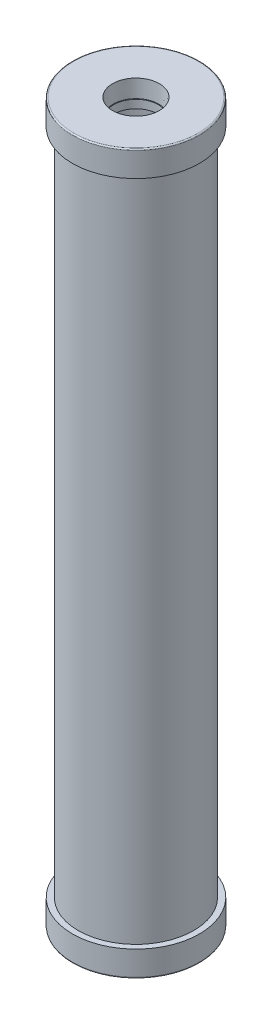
SolidWorks part; units mm, degrees
ref_plane "Front Plane" through (0, 0, 0) normal (0, 0, 1) x (1, 0, 0)
ref_plane "Top Plane" through (0, 0, 0) normal (0, 1, 0) x (1, 0, 0)
ref_plane "Right Plane" through (0, 0, 0) normal (1, 0, 0) x (0, 0, -1)
sketch "Sketch1" plane through (0, 0, 0) normal (0, 1, 0) x (1, 0, 0)
  circle A0 centre (0, 0) radius 57.15
  circle A1 centre (0, 0) radius 50.546
  dimension "D1" = 114.3
  dimension "D2" = 6.604
extrude "Boss-Extrude1" add sketch "Sketch1" along normal blind 711.2
sketch "Sketch2" plane through (0, 0, 0) normal (0, 1, 0) x (1, 0, 0)
  circle A0 centre (0, 0) radius 62.865
  dimension "D1" = 125.73
extrude "Boss-Extrude2" add sketch "Sketch2" along normal blind 25.4
hole_wizard "1-1/2 NPT Tapped Hole1" positions "Sketch4" profile "Sketch3" size "1-1/2" standard "ANSI Inch"
sketch "Sketch4" plane through (0, 0, 0) normal (0, 1, 0) x (1, 0, 0)
  point P0 (0, 0)
sketch "Sketch3" plane through (0, 0, 0) normal (1, 0, 0) x (0, 0, -1)
  line L0 (0, 0) -> (0, 41.5656)
  line L1 (21.8313, 28.448) -> (0, 41.5656)
  line L2 (-21.8313, 28.448) -> (0, 41.5656) construction
  line L3 (21.8313, 28.448) -> (21.8313, 17.272)
  line L4 (21.8313, 17.272) -> (22.6259, 17.272)
  line L5 (22.6259, 17.272) -> (23.143, 0)
  line L6 (-22.6259, 17.272) -> (-23.143, 0) construction
  line L7 (23.143, 0) -> (0, 0)
  line L8 (0, -6.35) -> (0, 107.95) construction
  line L11 (-21.8313, 17.272) -> (-22.6259, 17.272) construction
  dimension "Tap Drill Dia." = 43.6626
  dimension "Tap Drill Depth" = 28.448
  dimension "Thread Dia." = 46.2861
  dimension "Thread Angle" = 3.43
  dimension "Thread Depth" = 17.272
  dimension "Drill Angle" = 118
ref_plane "Plane1" through (0, 711.2, 0) normal (0, 1, 0) x (1, 0, 0)
sketch "Sketch5" plane through (0, 711.2, 0) normal (0, 1, 0) x (1, 0, 0)
  circle A0 centre (0, 0) radius 62.865
  dimension "D1" = 125.73
extrude "Boss-Extrude3" add sketch "Sketch5" against normal blind 25.4
hole_wizard "1-1/2 NPT Tapped Hole2" positions "Sketch7" profile "Sketch6" size "1-1/2" standard "ANSI Inch"
sketch "Sketch7" plane through (0, 711.2, 0) normal (0, 1, 0) x (1, 0, 0)
  point P0 (0, 0)
sketch "Sketch6" plane through (0, 711.2, 0) normal (1, 0, 0) x (0, 0, 1)
  line L0 (0, 0) -> (0, 41.5656)
  line L1 (21.8313, 28.448) -> (0, 41.5656)
  line L2 (-21.8313, 28.448) -> (0, 41.5656) construction
  line L3 (21.8313, 28.448) -> (21.8313, 17.272)
  line L4 (21.8313, 17.272) -> (22.6259, 17.272)
  line L5 (22.6259, 17.272) -> (23.143, 0)
  line L6 (-22.6259, 17.272) -> (-23.143, 0) construction
  line L7 (23.143, 0) -> (0, 0)
  line L8 (0, -6.35) -> (0, 107.95) construction
  line L11 (-21.8313, 17.272) -> (-22.6259, 17.272) construction
  dimension "Tap Drill Dia." = 43.6626
  dimension "Tap Drill Depth" = 28.448
  dimension "Thread Dia." = 46.2861
  dimension "Thread Angle" = 3.43
  dimension "Thread Depth" = 17.272
  dimension "Drill Angle" = 118
fillet "Fillet1" radius 1.27 2 edges at (0, 0, 62.865) (0, 711.2, 62.865)
